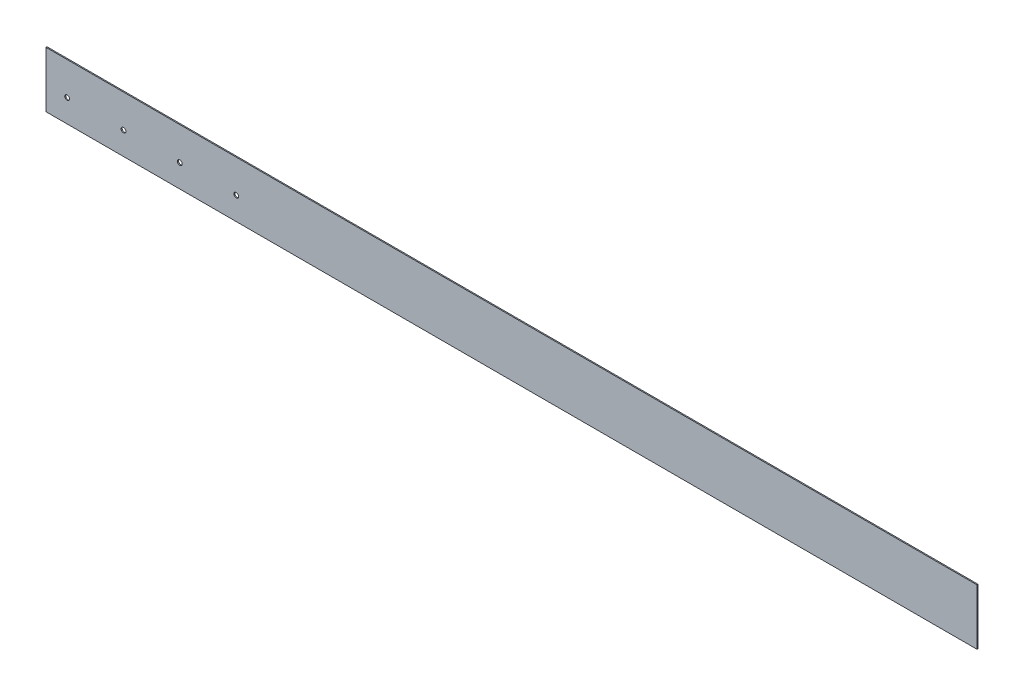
SolidWorks part; units mm, degrees
ref_plane "Front" through (0, 0, 0) normal (0, 0, 1) x (1, 0, 0)
ref_plane "Top" through (0, 0, 0) normal (0, 1, 0) x (1, 0, 0)
ref_plane "Right" through (0, 0, 0) normal (1, 0, 0) x (0, 0, -1)
sketch "Sketch1" plane through (0, 0, 0) normal (0, 0, 1) x (1, 0, 0)
  line L1 (0, 0) -> (8816.6546, 0)
  line L2 (0, 0) -> (0, 528.5351)
  line L3 (0, 528.5351) -> (8816.6546, 528.5351)
  line L4 (8816.6546, 0) -> (8816.6546, 528.5351)
extrude "Extrude1" add sketch "Sketch1" along normal blind 10
hole_wizard "Ø45.0 (45) Diameter Hole1" positions "Sketch3" profile "Sketch2" hole size "Ø45.0" standard "DIN"
sketch "Sketch3" plane through (0, 0, 10) normal (0, 0, 1) x (1, 0, 0)
  line L0 (0, 216.2998) -> (200, 216.2998)
  line L1 (0, 528.5351) -> (0, 0) construction
  line L2 (8816.6546, 0) -> (8816.6546, 528.5351) construction
  line L4 (8616.6546, 216.2998) -> (8816.6546, 216.2998)
  line L5 (200, 216.2998) -> (8616.6546, 216.2998)
  point P0 (200, 216.2998)
  dimension "D1" = 200
  dimension "D2" = 200
  dimension "D3" = 8416.6546
sketch "Sketch2" plane through (200, 216.2998, 10) normal (1, 0, 0) x (0, -1, 0)
  line L0 (0, 0) -> (0, 10)
  line L1 (0, 10) -> (22.5, 10)
  line L2 (22.5, 10) -> (22.5, 0)
  line L5 (22.5, 0) -> (0, 0)
  line L11 (0, -6.35) -> (0, 107.95) construction
  dimension "Thru Hole Dia." = 45
  dimension "Thru Hole Depth" = 10
pattern_linear "LPattern1" count 4 spacing 533.8174 along (1, 0, 0) of "Ø45.0 (45) Diameter Hole1"
equation "\"x\"=\"D3@Sketch3\" /700"
equation "\"D3@LPattern1\"=\"D3@Sketch3\" /(\"D1@LPattern1\"-1)"
equation "\"D1@LPattern1\" = Iif(\"x\"-int(\"x\")<>0,int(\"x\")+1,\"x\")+1"
